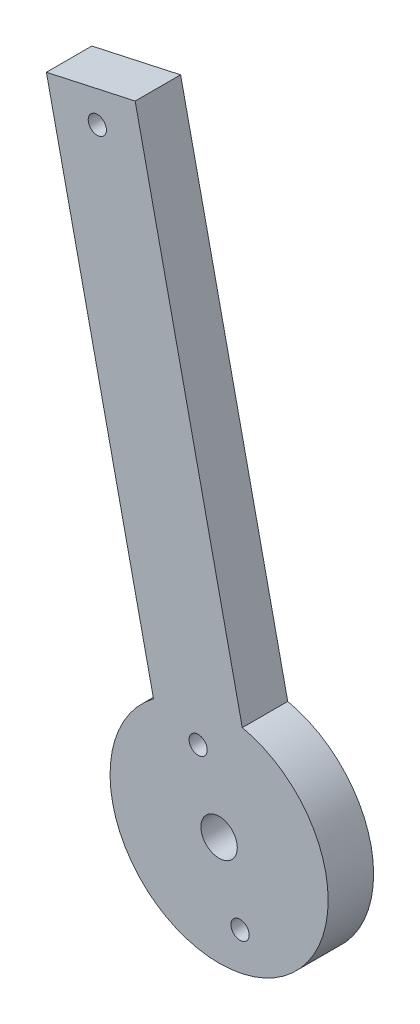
SolidWorks part; units mm, degrees
ref_plane "Front Plane" through (0, 0, 0) normal (0, 0, 1) x (1, 0, 0)
ref_plane "Top Plane" through (0, 0, 0) normal (0, 1, 0) x (1, 0, 0)
ref_plane "Right Plane" through (0, 0, 0) normal (1, 0, 0) x (0, 0, -1)
sketch "Sketch1" plane through (0, 0, 0) normal (0, 0, 1) x (1, 0, 0)
  line L1 (0, 0) -> (-1.8481, 8.4386) construction
  line L3 (-7.218, 9.5865) -> (-19.0039, 63.4023)
  line L4 (-19.0039, 63.4023) -> (-9.2354, 65.5416)
  line L5 (-9.2354, 65.5416) -> (2.5505, 11.7258)
  arc A0 (-7.218, 9.5865) -> (2.5505, 11.7258) centre (0, 0) ccw
extrude "Boss-Extrude1" add sketch "Sketch1" along normal blind 5
sketch "Sketch2" plane through (0, 0, 5) normal (0, 0, 1) x (1, 0, 0)
  line L0 (0, 0) -> (-14.1196, 64.472) construction
  line L1 (-9.2354, 65.5416) -> (-19.0039, 63.4023) construction
  circle A0 centre (0, 0) radius 2
  circle A1 centre (-13.4006, 61.1888) radius 1
  dimension "D1" = 62.639
extrude "Cut-Extrude1" cut sketch "Sketch2" against normal blind 5
sketch "Sketch3" plane through (0, 0, 5) normal (0, 0, 1) x (1, 0, 0)
  line L0 (0, 0) -> (9.3544, 0) construction
  line L1 (0, 0) -> (-2.8227, 9.3846) construction
  line L2 (0, 0) -> (2.199, -7.311) construction
  circle A0 centre (-2.3042, 7.661) radius 1
  circle A1 centre (2.3042, -7.661) radius 1
  circle A2 centre (0, 0) radius 2 construction
  dimension "D3" = 8
  dimension "D4" = 8
  dimension "D1" = 106.74
  dimension "D2" = 180
extrude "Cut-Extrude2" cut sketch "Sketch3" against normal blind 5
sketch "Sketch4" plane through (0, 0, 5) normal (0, 0, 1) x (1, 0, 0)
  line L0 (0, 0) -> (10.7048, 0)
